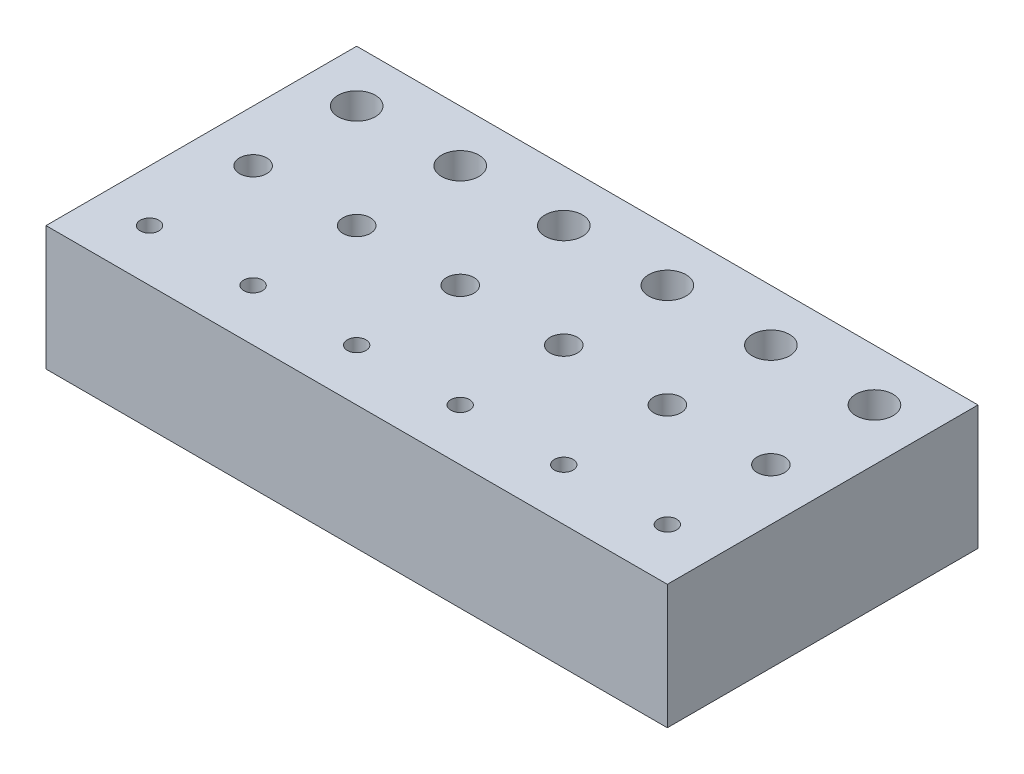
SolidWorks part; units mm, degrees
ref_plane "Front Plane" through (0, 0, 0) normal (0, 0, 1) x (1, 0, 0)
ref_plane "Top Plane" through (0, 0, 0) normal (0, 1, 0) x (1, 0, 0)
ref_plane "Right Plane" through (0, 0, 0) normal (1, 0, 0) x (0, 0, -1)
sketch "Sketch1" plane through (0, 0, 0) normal (0, 0, 1) x (1, 0, 0)
  line L1 (-75, 15) -> (75, 15)
  line L2 (-75, 15) -> (-75, -15)
  line L3 (-75, -15) -> (75, -15)
  line L4 (75, 15) -> (75, -15)
  line L5 (-75, 15) -> (75, -15) construction
  line L6 (-75, -15) -> (75, 15) construction
  point P0 (0, 0)
  dimension "D1" = 150
  dimension "D2" = 30
extrude "Boss-Extrude1" add sketch "Sketch1" along normal mid plane 75
hole_wizard "M8 Clearance Hole1" positions "Sketch2" profile "Sketch3" hole size "M8" standard "ANSI Metric"
sketch "Sketch2" plane through (0, 15, 0) normal (0, 1, 0) x (1, 0, 0)
  line L0 (-75, -37.5) -> (-75, 37.5) construction
  line L1 (75, 37.5) -> (-75, 37.5) construction
  point P0 (-62.5, 25)
  dimension "D1" = 12.5
  dimension "D2" = 12.5
sketch "Sketch3" plane through (-62.5, 15, -25) normal (1, 0, 0) x (0, 0, 1)
  line L0 (0, 0) -> (0, 30)
  line L1 (0, 30) -> (4.5, 30)
  line L2 (4.5, 30) -> (4.5, 0)
  line L5 (4.5, 0) -> (0, 0)
  line L11 (0, -6.35) -> (0, 107.95) construction
  dimension "Thru Hole Dia." = 9
  dimension "Thru Hole Depth" = 30
pattern_linear "LPattern1" count 6 spacing 25 along (1, 0, 0) of "M8 Clearance Hole1"
hole_wizard "M6 Clearance Hole1" positions "Sketch4" profile "Sketch5" hole size "M6" standard "ANSI Metric"
sketch "Sketch4" plane through (0, 15, 0) normal (0, 1, 0) x (1, 0, 0)
  line L0 (-16.5, 0) -> (16.5, 0) construction
  line L1 (-75, -37.5) -> (-75, 37.5) construction
  point P0 (-62.5, 0)
  dimension "D1" = 12.5
sketch "Sketch5" plane through (-62.5, 15, 0) normal (1, 0, 0) x (0, 0, 1)
  line L0 (0, 0) -> (0, 30)
  line L1 (0, 30) -> (3.3, 30)
  line L2 (3.3, 30) -> (3.3, 0)
  line L5 (3.3, 0) -> (0, 0)
  line L11 (0, -6.35) -> (0, 107.95) construction
  dimension "Thru Hole Dia." = 6.6
  dimension "Thru Hole Depth" = 30
pattern_linear "LPattern2" count 6 spacing 25 along (1, 0, 0) of "M6 Clearance Hole1"
hole_wizard "M4 Clearance Hole1" positions "Sketch6" profile "Sketch7" hole size "M4" standard "ANSI Metric"
sketch "Sketch6" plane through (0, 15, 0) normal (0, 1, 0) x (1, 0, 0)
  line L0 (75, -37.5) -> (-75, -37.5) construction
  line L1 (-75, -37.5) -> (-75, 37.5) construction
  point P0 (-62.5, -25)
  dimension "D1" = 12.5
  dimension "D2" = 12.5
sketch "Sketch7" plane through (-62.5, 15, 25) normal (1, 0, 0) x (0, 0, 1)
  line L0 (0, 0) -> (0, 30)
  line L1 (0, 30) -> (2.25, 30)
  line L2 (2.25, 30) -> (2.25, 0)
  line L5 (2.25, 0) -> (0, 0)
  line L11 (0, -6.35) -> (0, 107.95) construction
  dimension "Thru Hole Dia." = 4.5
  dimension "Thru Hole Depth" = 30
pattern_linear "LPattern3" count 6 spacing 25 along (1, 0, 0) of "M4 Clearance Hole1"
